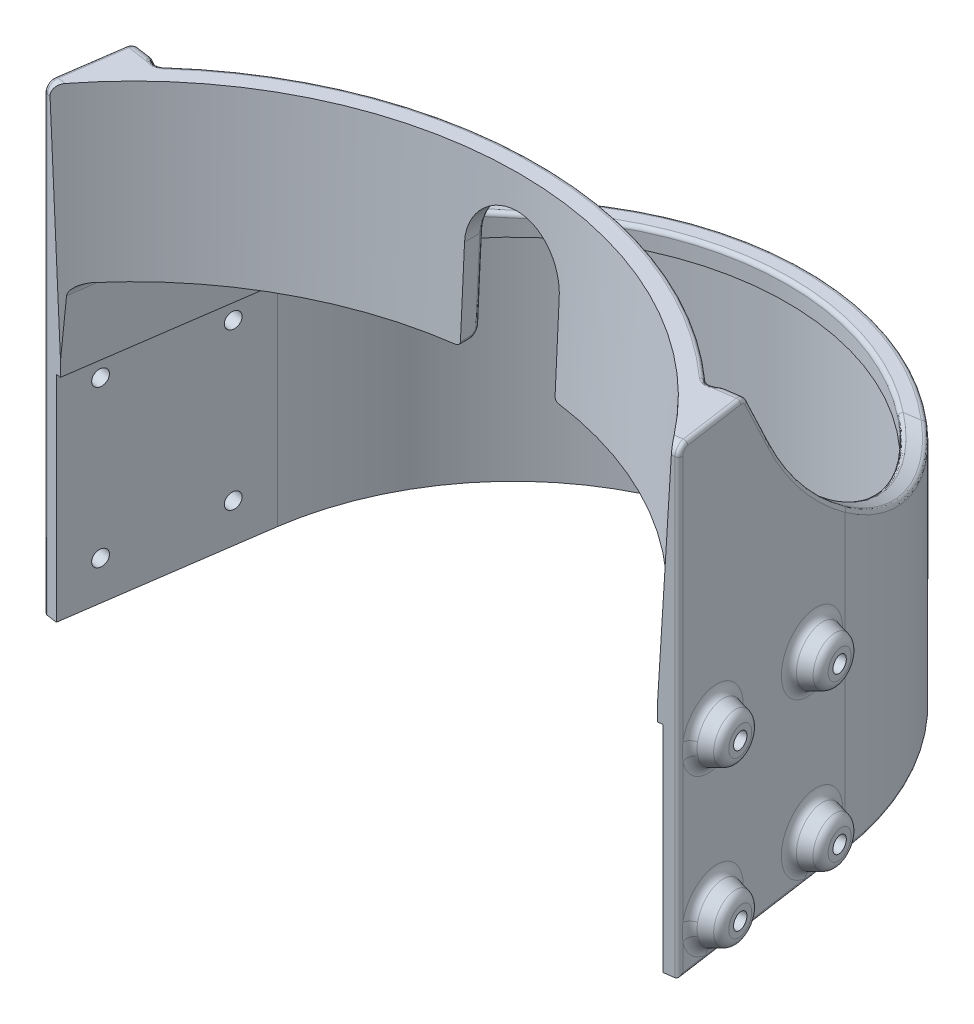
SolidWorks part; units mm, degrees
ref_plane "Front Plane" through (0, 0, 0) normal (0, 0, 1) x (1, 0, 0)
ref_plane "Top Plane" through (0, 0, 0) normal (0, 1, 0) x (1, 0, 0)
ref_plane "Right Plane" through (0, 0, 0) normal (1, 0, 0) x (0, 0, -1)
sketch "Sketch1" plane through (0, 0, 0) normal (0, 1, 0) x (1, 0, 0)
  line L0 (-94.2861, -143.8372) -> (-103.2971, -206.6946)
  line L1 (-103.2971, -206.6946) -> (-98.5828, -207.3704)
  line L2 (-98.5828, -207.3704) -> (-89.5718, -144.513)
  line L3 (0, -157.3537) -> (0, 60.4833) construction
  line L4 (103.2971, -206.6946) -> (98.5828, -207.3704)
  line L5 (98.5828, -207.3704) -> (89.5718, -144.513)
  line L6 (94.2861, -143.8372) -> (103.2971, -206.6946)
  line L8 (0, -157.3537) -> (-94.2861, -143.8372) construction
  line L9 (-89.5718, -144.513) -> (-107.0231, -266.2464) construction
  arc A0 (94.2861, -143.8372) -> (-94.2861, -143.8372) centre (0, -157.3537) ccw
  arc A1 (-89.5718, -144.513) -> (89.5718, -144.513) centre (0, -157.3537) cw
  arc A2 (89.5718, -144.513) -> (-89.5718, -144.513) centre (0, -157.3537) ccw construction
  dimension "D2" = 4.7625
  dimension "D3" = 63.5
extrude "Boss-Extrude1" add sketch "Sketch1" along normal blind 76.2
sketch "Sketch17" plane through (0, 76.2, 0) normal (0, 1, 0) x (1, 0, 0)
  line L10 (-97.0114, -207.5957) -> (-88.0003, -144.7383)
  line L11 (88.0003, -144.7383) -> (97.0114, -207.5957)
  line L12 (-98.5828, -207.3704) -> (-89.5718, -144.513)
  line L13 (89.5718, -144.513) -> (98.5828, -207.3704)
  line L14 (-98.5828, -207.3704) -> (-89.5718, -144.513)
  line L15 (89.5718, -144.513) -> (98.5828, -207.3704)
  line L16 (98.5828, -207.3704) -> (97.0114, -207.5957)
  line L17 (-97.0114, -207.5957) -> (-98.5828, -207.3704)
  arc A4 (88.0003, -144.7383) -> (-88.0003, -144.7383) centre (0, -157.3537) ccw
  arc A5 (89.5718, -144.513) -> (-89.5718, -144.513) centre (0, -157.3537) ccw
  arc A6 (89.5718, -144.513) -> (-89.5718, -144.513) centre (0, -157.3537) ccw
  dimension "D1" = 0
  dimension "D2" = 1.5875
extrude "Boss-Extrude5" add sketch "Sketch17" against normal blind 6.35
hole_wizard "1/4-20 Tapped Hole2" positions "Sketch14" profile "Sketch15" tap size "1/4-20" standard "ANSI Inch"
sketch "Sketch14" plane through (-72.1826, 0, -10.3479) normal (-0.9899, 0, -0.1419) x (-0.1419, 0, 0.9899)
  line L1 (168.4613, 63.5) -> (206.5613, 63.5) construction
  line L2 (168.4613, 63.5) -> (168.4613, 12.7) construction
  line L3 (168.4613, 12.7) -> (206.5613, 12.7) construction
  line L4 (206.5613, 63.5) -> (206.5613, 12.7) construction
  line L5 (168.4613, 63.5) -> (206.5613, 12.7) construction
  line L6 (168.4613, 12.7) -> (206.5613, 63.5) construction
  line L14 (155.7613, 0) -> (219.2613, 0) construction
  line L15 (219.2613, 76.2) -> (219.2613, 0) construction
  point P3 (206.5613, 12.7)
  point P110 (168.4613, 63.5)
  point P111 (168.4613, 12.7)
  point P112 (206.5613, 63.5)
  point P150 (187.5113, 38.1)
  dimension "D1" = 50.8
  dimension "D2" = 38.1
  dimension "D3" = 38.1
  dimension "D4" = 31.75
sketch "Sketch15" plane through (-101.4949, 12.7, 194.1231) normal (0, 1, 0) x (-0.1419, 0, 0.9899)
  line L0 (0, 0) -> (0, 13.6835)
  line L1 (0, 13.6835) -> (2.5527, 13.6835)
  line L2 (2.5527, 13.6835) -> (2.5527, 0)
  line L5 (2.5527, 0) -> (0, 0)
  line L11 (0, -6.35) -> (0, 107.95) construction
  dimension "Thread Major Dia." = 5.1054
  dimension "Thru Tap Drill Depth" = 13.6835
sketch "Sketch31" plane through (-72.1826, 0, -10.3479) normal (-0.9899, 0, -0.1419) x (-0.1419, 0, 0.9899)
  circle A0 centre (168.4613, 63.5) radius 9.525
  circle A1 centre (206.5613, 63.5) radius 9.525
  circle A2 centre (206.5613, 12.7) radius 9.525
  circle A3 centre (168.4613, 12.7) radius 9.525
  dimension "D1" = 19.05
extrude "Boss-Extrude6" add sketch "Sketch31" along normal blind 7.9375
hole_wizard "1/4-20 Tapped Hole3" positions "Sketch32" profile "Sketch33" tap size "1/4-20" standard "ANSI Inch"
sketch "Sketch32" plane through (-80.0398, 0, -11.4743) normal (-0.9899, 0, -0.1419) x (-0.1419, 0, 0.9899)
  point P0 (168.4613, 63.5)
  point P3 (206.5613, 63.5)
  point P6 (206.5613, 12.7)
  point P9 (168.4613, 12.7)
sketch "Sketch33" plane through (-103.9455, 63.5, 155.2823) normal (0, 1, 0) x (-0.1419, 0, 0.9899)
  line L0 (0, 0) -> (0, 206.1523)
  line L1 (0, 206.1523) -> (2.5527, 206.1523)
  line L2 (2.5527, 206.1523) -> (2.5527, 0)
  line L5 (2.5527, 0) -> (0, 0)
  line L11 (0, -6.35) -> (0, 107.95) construction
  dimension "Thread Major Dia." = 5.1054
  dimension "Thru Tap Drill Depth" = 206.1523
sketch "Sketch39" plane through (-72.1826, 0, -10.3479) normal (-0.9899, 0, -0.1419) x (-0.1419, 0, 0.9899)
  line L0 (219.2613, 76.2) -> (219.2613, 149.86)
  line L1 (219.2613, 149.86) -> (193.8613, 149.86)
  line L2 (193.8613, 149.86) -> (155.7613, 76.2)
  line L4 (155.7613, 76.2) -> (219.2613, 76.2)
  line L7 (219.2613, 76.2) -> (219.2613, 0) construction
  point P3 (165.7138, 76.2)
  point P6 (155.7613, 76.2)
  point P7 (228.6536, 76.2)
  point P9 (155.7613, 76.2)
  point P10 (216.9806, 76.2)
  point P13 (0, 0)
  dimension "D1" = 73.66
  dimension "D2" = 25.4
extrude "Boss-Extrude7" add sketch "Sketch39" against normal blind 6.35
mirror "Mirror2" about plane through (0, 0, 0) normal (1, 0, 0) of "Boss-Extrude7", "1/4-20 Tapped Hole3", "Boss-Extrude6", "1/4-20 Tapped Hole2"
sketch "Sketch36" plane through (0, 0, 0) normal (1, 0, 0) x (0, 0, -1)
  line L0 (-155.6512, 149.86) -> (-158.3162, 95.25)
  line L1 (-158.3162, 95.25) -> (-155.2174, 158.75) construction
  line L2 (-158.3162, 95.25) -> (-151.9587, 95.25)
  line L3 (-151.9587, 95.25) -> (-149.2937, 149.86)
  line L4 (-280.9474, 99.06) -> (-280.9474, 197.9835) construction
  line L6 (-149.2937, 149.86) -> (-155.6512, 149.86)
  line L10 (-206.6946, 149.86) -> (-181.5516, 149.86) construction
  line L11 (-167.2168, 95.25) -> (-158.3162, 95.25) construction
  point P5 (-153.9041, 76.5586)
  point P9 (-155.7524, 147.7878)
  dimension "D2" = 6.35
revolve "Revolve1" add sketch "Sketch36" about L4
sketch "Sketch44" plane through (0, 0, 0) normal (1, 0, 0) x (0, 0, -1)
  line L0 (-155.6512, 149.86) -> (-162.9644, 0)
  line L1 (-162.9644, 0) -> (-180.9521, 0)
  line L3 (-180.9521, 0) -> (-180.9521, 149.86)
  line L4 (-180.9521, 149.86) -> (-155.6512, 149.86)
  line L5 (-280.9474, 250.5823) -> (-280.9474, 56.4129) construction
  line L12 (-158.3162, 95.25) -> (-130.6953, 95.25) construction
  line L15 (-207.3704, 0) -> (-144.513, 0) construction
  point P6 (0, 0)
  dimension "D1" = 25.3009
chamfer "Chamfer4" distance 7.9375 angle 20 4 edges at (-110.7037, 12.7, 202.4253) (-105.2971, 12.7, 164.7109) (-110.7037, 63.5, 202.4253) (-105.2971, 63.5, 164.7109)
chamfer "Chamfer5" distance 7.9375 angle 20 4 edges at (110.7037, 12.7, 202.4253) (110.7037, 63.5, 202.4253) (105.2971, 63.5, 164.7109) (105.2971, 12.7, 164.7109)
fillet "Fillet1" radius 101.6 2 edges at (91.1432, 76.2, 144.2877) (-91.1432, 76.2, 144.2877)
sketch "Sketch43" plane through (0, 0, 0) normal (0, 0, 1) x (1, 0, 0)
  line L4 (-15.3859, 95.25) -> (15.3859, 95.25)
  line L6 (15.388, 123.8869) -> (15.3859, 95.25)
  line L7 (-15.3859, 95.25) -> (-15.388, 123.8869)
  line L8 (15.388, 123.8869) -> (15.3859, 95.25)
  line L9 (-15.3859, 95.25) -> (-15.388, 123.8869)
  spline S3 degree 3 poles (1909.9048, -410.5379) (303.615, -52.4488) (-26.7316, 67.4355) (-14.9986, 127.4018) (-14.878, 127.8924) (-14.5879, 128.865) (-14.4177, 129.3485) (-13.8438, 130.7557) (-13.3755, 131.6461) (-12.545, 132.9113) (-12.2457, 133.3225) (-11.6067, 134.1148) (-11.2702, 134.4922) (-10.2113, 135.5699) (-9.4397, 136.2162) (-8.1803, 137.0743) (-7.743, 137.3414) (-6.8535, 137.8258) (-6.3989, 138.0448) (-5.4703, 138.4372) (-4.9963, 138.6105) (-4.0285, 138.9106) (-3.532, 139.0379) (-2.0307, 139.3428) (-1.0243, 139.4436) (0.4934, 139.4448) (1.0006, 139.4201) (2.018, 139.3187) (2.5245, 139.2422) (4.0153, 138.9404) (4.9801, 138.6429) (6.3838, 138.0519) (6.8465, 137.8293) (7.7384, 137.3441) (8.1694, 137.081) (9.0026, 136.5147) (9.4046, 136.2116) (10.1798, 135.5652) (10.5536, 135.221) (11.6252, 134.1318) (12.2572, 133.3474) (13.0871, 132.0867) (13.3439, 131.6523) (13.817, 130.7547) (14.0333, 130.2907) (14.607, 128.8851) (14.8958, 127.9203) (15.1892, 126.4315) (15.2636, 125.9269) (22.7276, 49.5704) (-521.7775, -61.4041) (-1948.8723, -239.1373) knots -3.693265 -3.693265 -3.693265 -3.693265 0.0625 0.0625 0.09375 0.09375 0.125 0.125 0.1875 0.1875 0.21875 0.21875 0.25 0.25 0.3125 0.3125 0.34375 0.34375 0.375 0.375 0.40625 0.40625 0.4375 0.4375 0.5 0.5 0.53125 0.53125 0.5625 0.5625 0.625 0.625 0.65625 0.65625 0.6875 0.6875 0.71875 0.71875 0.75 0.75 0.8125 0.8125 0.84375 0.84375 0.875 0.875 0.9375 0.9375 0.96875 0.96875 5.627231 5.627231 5.627231 5.627231 only from (-15.388, 123.8869) to (15.388, 123.8869)
  spline S4 degree 3 poles (-15.388, 123.8869) (-15.388, 124.9108) (-15.2891, 125.9172) (-14.9986, 127.4018) (-14.878, 127.8924) (-14.5879, 128.865) (-14.4177, 129.3485) (-13.8438, 130.7557) (-13.3755, 131.6461) (-12.545, 132.9113) (-12.2457, 133.3225) (-11.6067, 134.1148) (-11.2702, 134.4922) (-10.2113, 135.5699) (-9.4397, 136.2162) (-8.1803, 137.0743) (-7.743, 137.3414) (-6.8535, 137.8258) (-6.3989, 138.0448) (-5.4703, 138.4372) (-4.9963, 138.6105) (-4.0285, 138.9106) (-3.532, 139.0379) (-2.0307, 139.3428) (-1.0243, 139.4436) (0.4934, 139.4448) (1.0006, 139.4201) (2.018, 139.3187) (2.5245, 139.2422) (4.0153, 138.9404) (4.9801, 138.6429) (6.3838, 138.0519) (6.8465, 137.8293) (7.7384, 137.3441) (8.1694, 137.081) (9.0026, 136.5147) (9.4046, 136.2116) (10.1798, 135.5652) (10.5536, 135.221) (11.6252, 134.1318) (12.2572, 133.3474) (13.0871, 132.0867) (13.3439, 131.6523) (13.817, 130.7547) (14.0333, 130.2907) (14.607, 128.8851) (14.8958, 127.9203) (15.1892, 126.4315) (15.2636, 125.9269) (15.3631, 124.9093) (15.388, 124.3989) (15.388, 123.8869) knots 0 0 0 0 0.0625 0.0625 0.09375 0.09375 0.125 0.125 0.1875 0.1875 0.21875 0.21875 0.25 0.25 0.3125 0.3125 0.34375 0.34375 0.375 0.375 0.40625 0.40625 0.4375 0.4375 0.5 0.5 0.53125 0.53125 0.5625 0.5625 0.625 0.625 0.65625 0.65625 0.6875 0.6875 0.71875 0.71875 0.75 0.75 0.8125 0.8125 0.84375 0.84375 0.875 0.875 0.9375 0.9375 0.96875 0.96875 1 1 1 1
  dimension "D1" = 0
extrude "Cut-Extrude5" cut sketch "Sketch43" along normal blind 190.5
revolve "Cut-Revolve2" cut sketch "Sketch44" angle 360 about L5
fillet "Fillet2" radius 3.175 4 edges at (95.8705, 95.25, 199.6372) (-95.8705, 95.25, 199.6372)
fillet "Fillet4" radius 3.175 6 edges at (54.5917, 95.25, 164.0806) (89.2308, 95.25, 187.5492) (-54.5917, 95.25, 164.0806) (-89.9013, 95.25, 187.7612) (92.4885, 94.8193, 187.1684) (-92.4885, 94.8193, 187.1684)
fillet "Fillet3" radius 3.175 4 edges at (-102.2234, 149.86, 206.8485) (102.2234, 149.86, 206.8485) (95.9795, 149.86, 182.0839) (-95.9795, 149.86, 182.0839)
fillet "Fillet5" radius 1.27 37 edges at (-98.7916, 0, 175.2659) (0, 0, 62.1037) (-103.2971, 73.3425, 206.6946) (-103.1652, 148.9301, 205.774) (-101.4067, 149.86, 193.508) (-99.7327, 149.3972, 181.8304) (103.2971, 73.3425, 206.6946) (103.1652, 148.9301, 205.774) (101.4067, 149.86, 193.508) (99.7327, 149.3972, 181.8304) (98.9421, 139.6331, 176.3154) (96.5672, 112.5873, 159.7492) (79.5963, 78.467, 105.0374) (0, 76.2, 62.1037) (-88.6523, 84.3774, 122.5209) (-96.5672, 112.5873, 159.7492) (-90.842, 149.6159, 183.5392) (91.1536, 149.5878, 183.4285) (92.5675, 138.4227, 176.5967) (90.2814, 112.5873, 160.6503) (82.4678, 84.6964, 124.1533) (0, 76.2, 68.4537) (-71.6447, 78.1681, 104.7206) (-90.2814, 112.5873, 160.6503) (15.3859, 95.25, 157.6054) (15.386, 96.3329, 153.5198) (-15.3859, 95.25, 157.6054) (-15.3859, 95.9546, 153.9164) (98.7916, 0, 175.2659) (-98.9421, 139.6331, 176.3154) (-92.5675, 138.4227, 176.5967) (0, 149.86, 149.2937) (-1.9181, 139.3232, 149.8219)
fillet "Fillet6" radius 3.175 16 edges at (-104.8871, 63.5, 161.8511) (-94.7366, 63.5, 146.98) (-104.8871, 12.7, 161.8511) (-94.7366, 12.7, 146.98) (-110.2938, 12.7, 199.5655) (-100.1433, 12.7, 184.6945) (-110.2938, 63.5, 199.5655) (-100.1433, 63.5, 184.6945) (102.8466, 12.7, 203.5517) (108.4104, 12.7, 186.4279) (97.4399, 12.7, 165.8373) (103.0038, 12.7, 148.7134) (97.4399, 63.5, 165.8373) (103.0038, 63.5, 148.7134) (102.8466, 63.5, 203.5517) (108.4104, 63.5, 186.4279)
